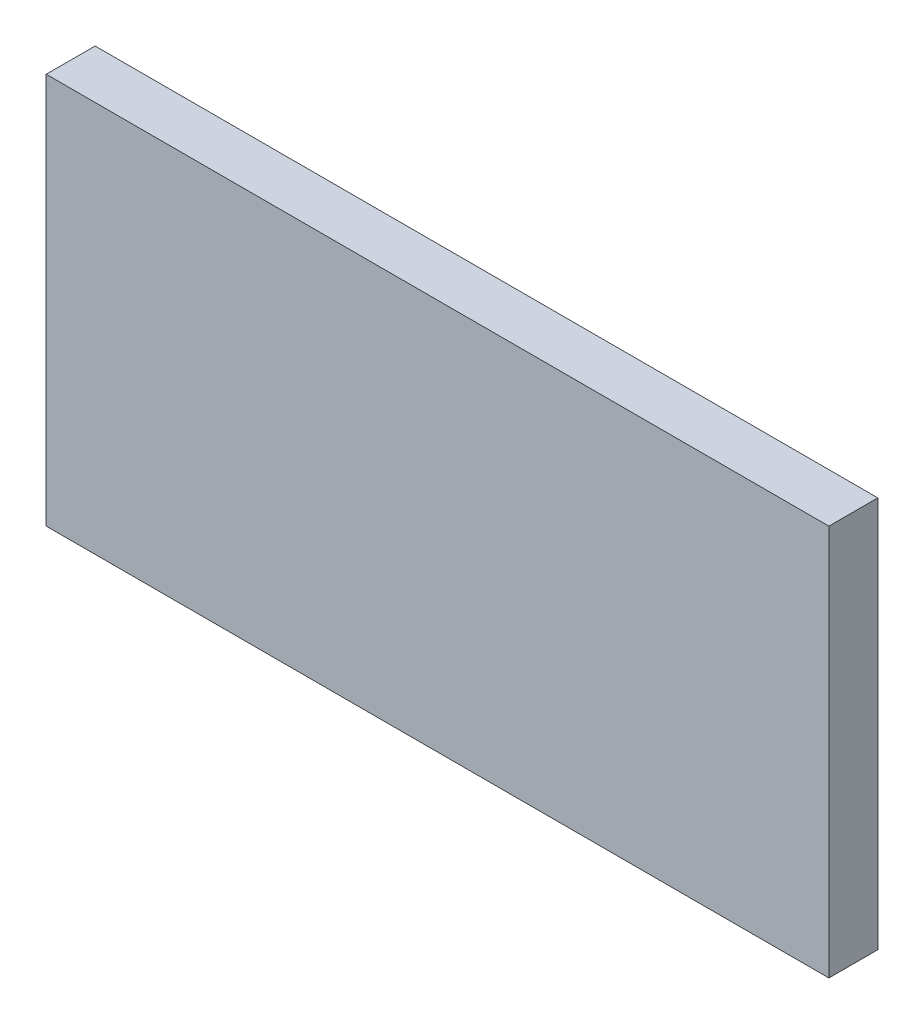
SolidWorks part; units mm, degrees
ref_plane "Płaszczyzna przednia" through (0, 0, 0) normal (0, 0, 1) x (1, 0, 0)
ref_plane "Płaszczyzna górna" through (0, 0, 0) normal (0, 1, 0) x (1, 0, 0)
ref_plane "Płaszczyzna prawa" through (0, 0, 0) normal (1, 0, 0) x (0, 0, -1)
sketch "Szkic1" plane through (0, 0, 0) normal (0, 0, 1) x (1, 0, 0)
  line L1 (400, -200) -> (-400, -200)
  line L2 (400, -200) -> (400, 200)
  line L3 (400, 200) -> (-400, 200)
  line L4 (-400, -200) -> (-400, 200)
  line L5 (400, -200) -> (-400, 200) construction
  line L6 (400, 200) -> (-400, -200) construction
  point P0 (0, 0)
  dimension "D1" = 400
  dimension "D2" = 800
extrude "Dodanie-wyciągnięcie1" add sketch "Szkic1" along normal blind 50
sketch "Szkic3" plane through (0, 0, 0) normal (0, 1, 0) x (1, 0, 0)
  line L0 (-300, 0) -> (-300, 60)
  line L1 (400, 0) -> (-400, 0) construction
  line L2 (-240, 60) -> (-240, 0)
  line L3 (-240, 0) -> (-300, 0)
  line L4 (-400, -50) -> (-400, 0) construction
  circle A0 centre (-270, 60) radius 20
  arc A1 (-300, 60) -> (-240, 60) centre (-270, 60) cw
  dimension "D1" = 40
  dimension "D2" = 30
  dimension "D3" = 60
  dimension "D4" = 100
extrude "Dodanie-wyciągnięcie2" add sketch "Szkic3" along normal blind 20 from offset 20
mirror "Lustro1" about plane through (0, 0, 0) normal (0, 1, 0) of "Dodanie-wyciągnięcie2"
pattern_linear "Szyk liniowy1" count 2 spacing 400 along (1, 0, 0) of "Dodanie-wyciągnięcie2", "Lustro1"
